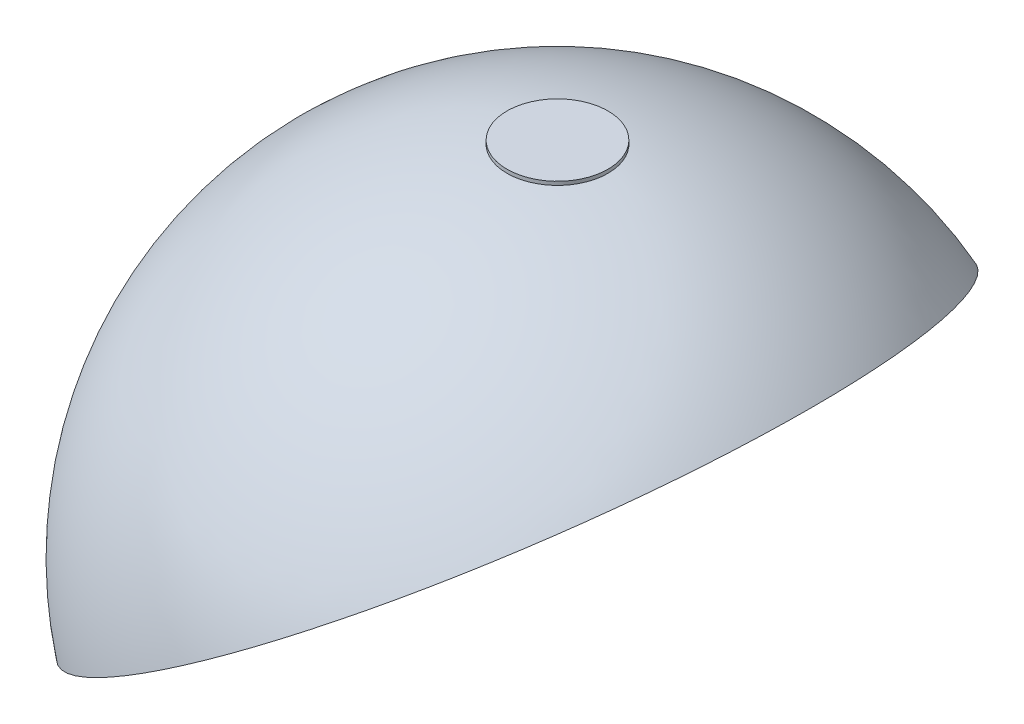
SolidWorks part; units mm, degrees
ref_plane "Płaszczyzna przednia" through (0, 0, 0) normal (0, 0, 1) x (1, 0, 0)
ref_plane "Płaszczyzna górna" through (0, 0, 0) normal (0, 1, 0) x (1, 0, 0)
ref_plane "Płaszczyzna prawa" through (0, 0, 0) normal (1, 0, 0) x (0, 0, -1)
sketch "Szkic1" plane through (0, 0, 0) normal (0, 0, 1) x (1, 0, 0)
  line L0 (35.1495, 35.56) -> (-46.2741, -18.9395)
  line L1 (-27.8116, 41.5513) -> (0, 0) construction
  line L2 (0, 0) -> (43.6504, -65.2148) construction
  line L3 (0, 50) -> (0, -60.8615) construction
  circle A0 centre (0, 0) radius 50
  point P8 (-27.8116, 41.5513)
  dimension "D1" = 100
  dimension "D2" = 40
  dimension "D3" = 38
sketch "Szkic3" plane through (0, 0, 0) normal (0, 0, 1) x (1, 0, 0)
  line L0 (-27.8116, 41.5513) -> (0, 0) construction
  line L3 (-27.8116, 41.5513) -> (0, 0) construction
  line L4 (35.1495, 35.56) -> (29.1921, 31.5725)
  line L5 (35.1495, 35.56) -> (-46.2741, -18.9395) construction
  line L6 (29.1921, 31.5725) -> (22.6945, 41.28)
  line L7 (22.6945, 41.28) -> (-10.0413, 41.8111)
  line L8 (-10.0413, 41.8111) -> (-23.918, 35.7341)
  line L9 (-27.8116, 41.5513) -> (-23.918, 35.7341)
  circle A0 centre (0, 0) radius 50 construction
  arc A1 (35.1495, 35.56) -> (-27.8116, 41.5513) centre (0, 0) ccw
revolve "Obrót1" add sketch "Szkic3" angle 360 about L3
sketch "Szkic4" plane through (0, 0, 0) normal (0, 0, 1) x (1, 0, 0)
  line L0 (0, 49.305) -> (6.9806, 49.305)
  line L1 (0, 50) -> (0, -60.8615) construction
  line L2 (6.9806, 49.305) -> (6.9806, 50.005)
  line L3 (6.9806, 50.005) -> (0, 50.005)
  line L4 (0, 50.005) -> (0, 49.305)
revolve "Obrót2" add sketch "Szkic4" angle 360 about L4
